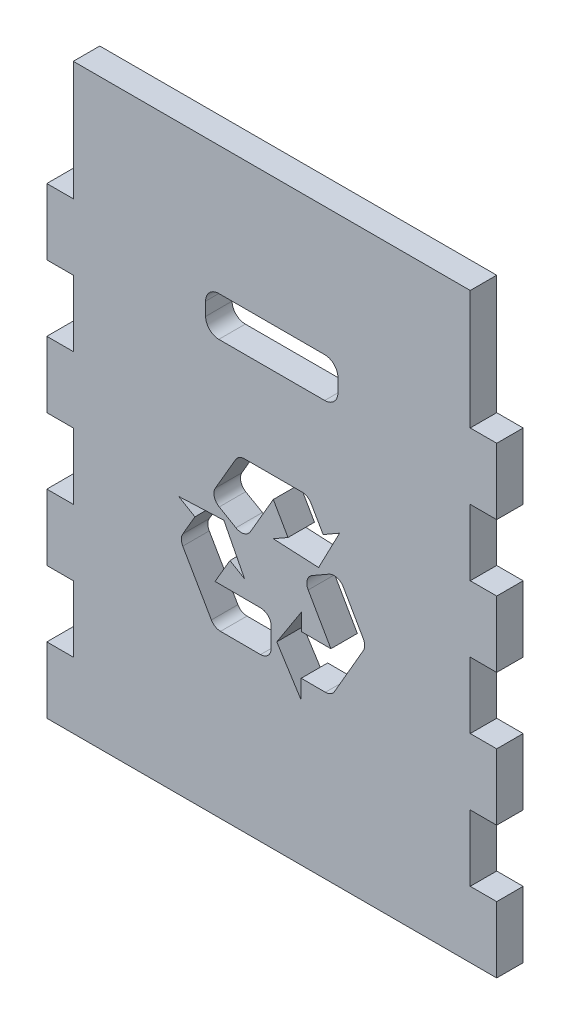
SolidWorks part; units mm, degrees
ref_plane "Front" through (0, 0, 0) normal (0, 0, 1) x (1, 0, 0)
ref_plane "Top" through (0, 0, 0) normal (0, 1, 0) x (1, 0, 0)
ref_plane "Right" through (0, 0, 0) normal (1, 0, 0) x (0, 0, -1)
sketch "Sketch1" plane through (0, 0, 0) normal (0, 0, 1) x (1, 0, 0)
  line L0 (0, 50) -> (20, 50)
  line L1 (20, 50) -> (320, 50)
  line L2 (0, 50) -> (0, 100)
  line L3 (20, 490) -> (320, 490)
  line L4 (340, 50) -> (340, 100)
  line L5 (0, 100) -> (20, 100)
  line L6 (0, 150) -> (20, 150)
  line L7 (0, 200) -> (20, 200)
  line L8 (0, 250) -> (20, 250)
  line L9 (0, 300) -> (20, 300)
  line L10 (0, 350) -> (20, 350)
  line L11 (0, 400) -> (20, 400)
  line L12 (320, 490) -> (320, 400)
  line L14 (20, 100) -> (20, 150)
  line L15 (0, 150) -> (0, 200)
  line L16 (20, 200) -> (20, 250)
  line L17 (0, 250) -> (0, 300)
  line L18 (20, 300) -> (20, 350)
  line L19 (0, 350) -> (0, 400)
  line L20 (20, 400) -> (20, 490)
  line L21 (320, 350) -> (340, 350)
  line L22 (320, 400) -> (340, 400)
  line L23 (320, 300) -> (340, 300)
  line L24 (320, 250) -> (340, 250)
  line L25 (320, 200) -> (340, 200)
  line L26 (320, 150) -> (340, 150)
  line L27 (320, 100) -> (340, 100)
  line L28 (320, 50) -> (340, 50)
  line L30 (340, 150) -> (340, 200)
  line L31 (320, 150) -> (320, 100)
  line L32 (340, 250) -> (340, 300)
  line L33 (320, 250) -> (320, 200)
  line L34 (340, 350) -> (340, 400)
  line L35 (320, 350) -> (320, 300)
  line L38 (20, 0) -> (320, 0)
  dimension "D1" = 440
  dimension "D2" = 300
  dimension "D3" = 20
  dimension "D5" = 50
extrude "Extrude1" add sketch "Sketch1" along normal blind 20
sketch "Sketch2" plane through (0, 0, 20) normal (0, 0, 1) x (1, 0, 0)
  line L0 (170, 494.8097) -> (170, 44.8097) construction
  line L1 (130, 393) -> (210, 393)
  line L2 (120, 383) -> (120, 373)
  line L3 (130, 363) -> (210, 363)
  line L4 (220, 383) -> (220, 373)
  line L5 (320, 490) -> (20, 490) construction
  line L6 (340, 350) -> (340, 400) construction
  arc A0 (130, 393) -> (120, 383) centre (130, 383) ccw
  arc A1 (130, 363) -> (120, 373) centre (130, 373) cw
  arc A2 (220, 373) -> (210, 363) centre (210, 373) cw
  arc A3 (210, 393) -> (220, 383) centre (210, 383) cw
  dimension "D2" = 10
  dimension "D1" = 50
  dimension "D3" = 127
  dimension "D4" = 170
  dimension "D5" = 97
  dimension "D6" = 100
extrude "Extrude2" cut sketch "Sketch2" against normal through all
sketch "Sketch3" plane through (0, 0, 20) normal (0, 0, 1) x (1, 0, 0)
  line L0 (149.5131, 294.4986) -> (192.7904, 294.4986)
  line L1 (173.7968, 186.9225) -> (192.406, 215.7346)
  line L2 (171.1678, 278.796) -> (153.8334, 249.0029)
  line L3 (192.2125, 157.9863) -> (173.7968, 186.9225)
  line L4 (192.2605, 172.3284) -> (210.5124, 172.2673)
  line L5 (142.5983, 290.5218) -> (127.3924, 264.3871)
  line L6 (192.2605, 172.3284) -> (192.2125, 157.9863)
  line L7 (171.1414, 253.0612) -> (182.2614, 259.4317)
  line L8 (221.2497, 281.7677) -> (205.398, 251.3512)
  line L9 (205.398, 251.3512) -> (171.1414, 253.0612)
  line L10 (208.8049, 274.6383) -> (221.2497, 281.7677)
  line L11 (182.2614, 259.4317) -> (171.1678, 278.796)
  line L12 (208.8049, 274.6383) -> (199.732, 290.4754)
  line L13 (130.2839, 253.4491) -> (142.8954, 246.1114)
  line L14 (192.363, 202.9191) -> (214.6798, 202.8443)
  line L15 (192.406, 215.7346) -> (192.363, 202.9191)
  line L16 (214.6798, 202.8443) -> (197.5455, 232.7529)
  line L17 (213.1707, 250.9242) -> (200.5103, 243.6712)
  line L18 (239.1194, 221.7233) -> (224.089, 247.9594)
  line L19 (239.1061, 213.7465) -> (217.4674, 176.2672)
  line L20 (133.8005, 246.5043) -> (149.4479, 215.9822)
  line L21 (99.5332, 245.024) -> (133.8005, 246.5043)
  line L22 (111.9298, 237.8112) -> (102.7509, 222.0353)
  line L23 (111.9298, 237.8112) -> (99.5332, 245.024)
  line L24 (138.3709, 222.4271) -> (127.1477, 203.1377)
  line L25 (149.4479, 215.9822) -> (138.3709, 222.4271)
  line L26 (127.1477, 203.1377) -> (161.6164, 203.0221)
  line L27 (169.5407, 180.4046) -> (169.5896, 194.9954)
  line L28 (131.2776, 172.5328) -> (161.5139, 172.4315)
  line L29 (124.3762, 176.5328) -> (102.7375, 214.0121)
  arc A0 (197.5455, 232.7529) -> (200.5103, 243.6712) centre (204.487, 236.7296) cw
  arc A1 (149.5131, 294.4986) -> (142.5983, 290.5218) centre (149.5131, 286.4986) ccw
  arc A2 (192.7904, 294.4986) -> (199.732, 290.4754) centre (192.7904, 286.4986) cw
  arc A3 (127.3924, 264.3871) -> (130.2839, 253.4491) centre (134.3071, 260.3639) ccw
  arc A4 (153.8334, 249.0029) -> (142.8954, 246.1114) centre (146.9186, 253.0261) cw
  arc A6 (224.089, 247.9594) -> (213.1707, 250.9242) centre (217.1474, 243.9827) ccw
  arc A7 (239.1061, 213.7465) -> (239.1194, 221.7233) centre (232.1779, 217.7465) ccw
  arc A8 (217.4674, 176.2672) -> (210.5124, 172.2673) centre (210.5392, 180.2672) cw
  arc A9 (161.6164, 203.0221) -> (169.5896, 194.9954) centre (161.5896, 195.0222) cw
  arc A10 (161.5139, 172.4315) -> (169.5407, 180.4046) centre (161.5407, 180.4314) ccw
  arc A11 (124.3762, 176.5328) -> (131.2776, 172.5328) centre (131.3044, 180.5328) ccw
  arc A12 (102.7375, 214.0121) -> (102.7509, 222.0353) centre (109.6657, 218.0121) cw
extrude "Extrude3" cut sketch "Sketch3" against normal through all
